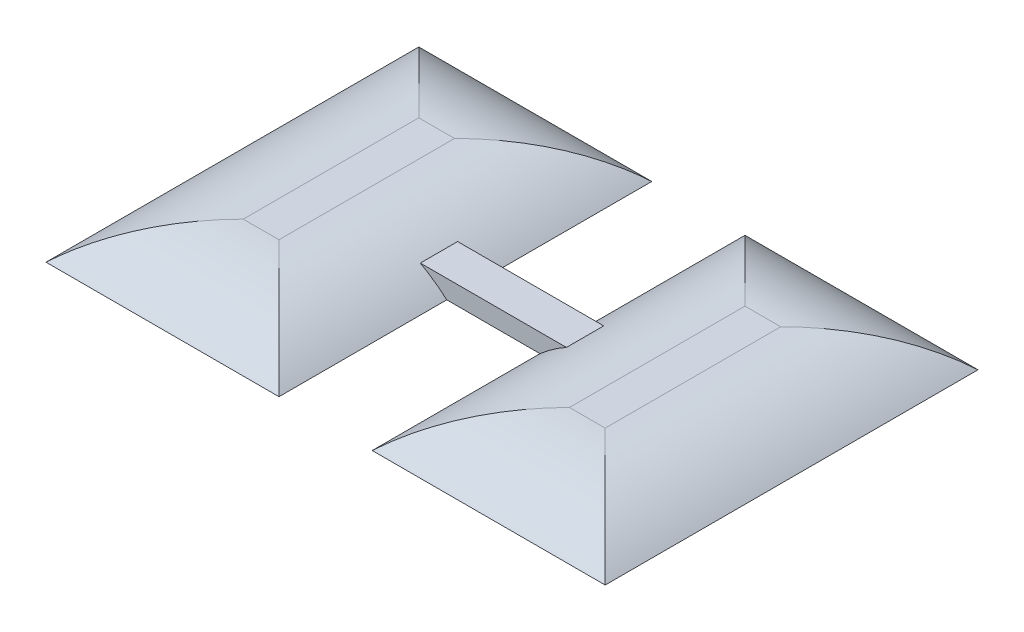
SolidWorks part; units mm, degrees
ref_plane "Plan de face" through (0, 0, 0) normal (0, 0, 1) x (1, 0, 0)
ref_plane "Plan de dessus" through (0, 0, 0) normal (0, 1, 0) x (1, 0, 0)
ref_plane "Plan de droite" through (0, 0, 0) normal (1, 0, 0) x (0, 0, -1)
sketch "Esquisse1" plane through (0, 0, 0) normal (0, 1, 0) x (1, 0, 0)
  line L0 (-0.25, 0) -> (0.25, 0) construction
  line L1 (-1.5, 1) -> (-0.25, 1)
  line L2 (-1.5, 1) -> (-1.5, -1)
  line L3 (-1.5, -1) -> (-0.25, -1)
  line L4 (-0.25, 1) -> (-0.25, -1)
  line L5 (1.5, 1) -> (0.25, 1)
  line L6 (1.5, 1) -> (1.5, -1)
  line L7 (1.5, -1) -> (0.25, -1)
  line L8 (0.25, 1) -> (0.25, -1)
  point P10 (0, 0)
  dimension "D1" = 2
  dimension "D2" = 3
  dimension "D3" = 0.5
extrude "Boss.-Extru.1" add sketch "Esquisse1" along normal blind 0.2
fillet "Congé1" radius 0.8 4 edges at (-1.5, 0.2, 0) (-0.875, 0.2, -1) (-0.25, 0.2, 0) (-0.875, 0.2, 1)
fillet "Congé2" radius 0.8 4 edges at (1.5, 0.2, 0) (0.875, 0.2, -1) (0.25, 0.2, 0) (0.875, 0.2, 1)
sketch "Esquisse2" plane through (0, 0, 0) normal (0, 1, 0) x (1, 0, 0)
  line L1 (-0.5, 0.1) -> (0.5, 0.1)
  line L2 (-0.5, 0.1) -> (-0.5, -0.1)
  line L3 (-0.5, -0.1) -> (0.5, -0.1)
  line L4 (0.5, 0.1) -> (0.5, -0.1)
  point P4 (-0.5, 0)
  point P6 (0, 0.1)
  dimension "D1" = 0.2
  dimension "D2" = 1
extrude "Boss.-Extru.2" add sketch "Esquisse2" along normal blind 0.1
